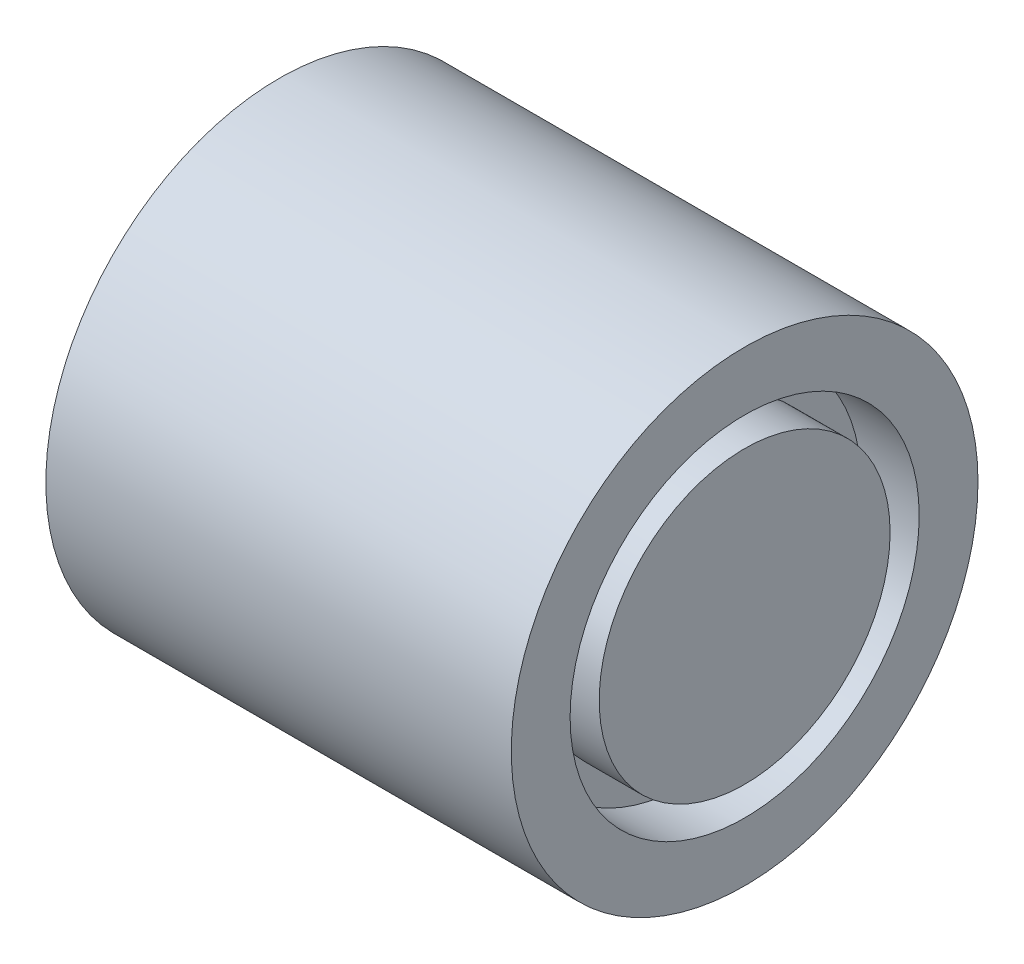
SolidWorks part; units mm, degrees
ref_plane "Front Plane" through (0, 0, 0) normal (0, 0, 1) x (1, 0, 0)
ref_plane "Top Plane" through (0, 0, 0) normal (0, 1, 0) x (1, 0, 0)
ref_plane "Right Plane" through (0, 0, 0) normal (1, 0, 0) x (0, 0, -1)
sketch "Sketch1" plane through (0, 0, 0) normal (0, 0, 1) x (1, 0, 0)
  line L0 (0, 0.0685) -> (0, 25.4685)
  line L1 (0, 25.4685) -> (-50.8, 25.4685)
  line L2 (-50.8, 25.4685) -> (-50.8, 0)
  line L3 (-50.8, 0) -> (0, 0)
  line L4 (11.5896, 0) -> (-61.8112, 0) construction
  line L5 (0, 0.0685) -> (0, 0)
  dimension "D1" = 25.4
  dimension "D2" = 50.8
revolve "Revolve1" add sketch "Sketch1" angle 360 about L4
sketch "Sketch2" plane through (0, 0, 0) normal (1, 0, 0) x (0, 0, -1)
  circle A0 centre (0, 0) radius 19.05
  circle A1 centre (0, 0) radius 15.875
  dimension "D1" = 38.1
  dimension "D2" = 31.75
extrude "Cut-Extrude1" cut sketch "Sketch2" against normal blind 6.35
sketch "Sketch3" plane through (-50.8, 0, 0) normal (-1, 0, 0) x (0, 0, 1)
  circle A0 centre (0, 0) radius 19.05
  circle A1 centre (0, 0) radius 15.875
  dimension "D1" = 38.1
  dimension "D2" = 31.75
extrude "Cut-Extrude2" cut sketch "Sketch3" against normal blind 6.35
